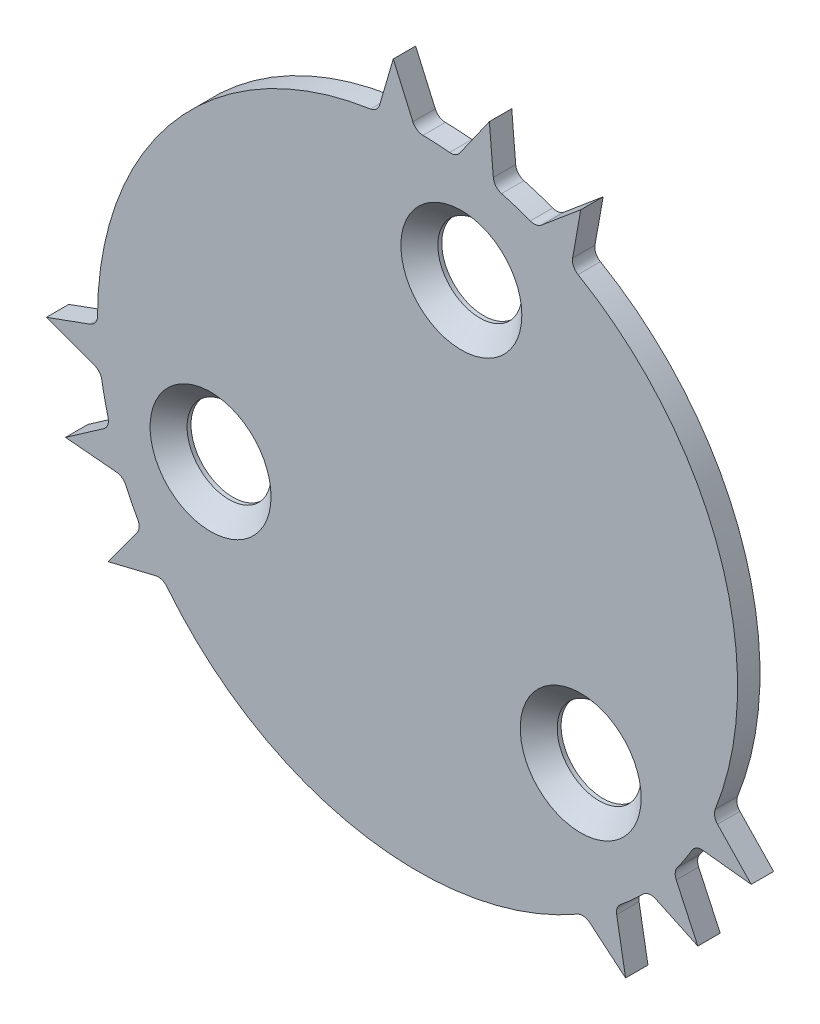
SolidWorks part; units mm, degrees
ref_plane "Ebene vorne" through (0, 0, 0) normal (0, 0, 1) x (1, 0, 0)
ref_plane "Ebene oben" through (0, 0, 0) normal (0, 1, 0) x (1, 0, 0)
ref_plane "Ebene rechts" through (0, 0, 0) normal (1, 0, 0) x (0, 0, -1)
sketch "Skizze1" plane through (0, 0, 0) normal (0, 0, 1) x (1, 0, 0)
  line L0 (-3.8571, 58.9672) -> (0.4306, -6.5833) construction
  line L1 (-14.9168, 27.6679) -> (25.0031, 30.2791) construction
  line L2 (-2.1689, 33.159) -> (-3.5687, 28.3589) construction
  line L3 (-2.1689, 33.159) -> (-0.1558, 28.5821) construction
  line L4 (-21.4185, -20.1239) -> (-26.1191, -11.9029) construction
  line L6 (0, 0) -> (17.5623, 64.9986) construction
  line L10 (0, 0) -> (45.6735, 79.1088) construction
  line L12 (-9.2404, 32.1042) -> (28.3981, 21.9345) construction
  line L13 (-6.8405, 36.9537) -> (29.8586, 15.7654) construction
  line L14 (6.4132, 32.6051) -> (3.4381, 28.375) construction
  line L15 (6.4132, 32.6051) -> (6.8273, 27.7552) construction
  line L16 (10.6094, 26.5406) -> (14.571, 29.8648) construction
  line L17 (14.571, 29.8648) -> (13.7258, 25.0712) construction
  line L28 (20.1686, -20.2532) -> (17.0795, -23.3293) construction
  line L30 (26.358, -11.539) -> (23.183, -16.9854) construction
  circle A0 centre (0, 0) radius 28.5826
  dimension "D1" = 20
  dimension "D2" = 20
  dimension "D10" = 20
  dimension "D11" = 20
  dimension "D12" = 20
  dimension "D13" = 20
  dimension "D15" = 14.88
extrude "Linear austragen2" add sketch "Skizze1" along normal blind 2
hole_wizard "Formsenkung für M5 SFHCS2" positions "3D-Skizze3" profile "Skizze5" countersink size "M5" standard "Ansi Metrisch"
sketch3d "3D-Skizze3"
  line L3 (0, 0, 0) -> (3.9125, 19.0844, 2) construction
  line L6 (0, 0, 0) -> (0, 11.9967, 0) construction
  point P0 (3.9125, 19.0844, 2)
  dimension "D1" = 19.5837
  dimension "D2" = 12.966
sketch "Skizze5" plane through (3.9125, 19.0844, 2) normal (1, 0, 0) x (0, -1, 0)
  line L0 (0, 0) -> (0, 2)
  line L1 (0, 2) -> (3.75, 2)
  line L2 (3.75, 2) -> (3.75, 1.65)
  line L3 (3.75, 1.65) -> (5.4, 0)
  line L5 (5.4, 0) -> (0, 0)
  line L6 (-3.75, 1.65) -> (-5.4, 0) construction
  line L11 (0, -6.35) -> (0, 107.95) construction
  dimension "Bohrerdurchmesser" = 7.5
  dimension "Bohrungstiefe" = 2
  dimension "Senkdurchmesser (Oben)" = 10.8
  dimension "Senkwinkel (Oben)" = 90
sketch "Skizze6" plane through (0, 0, 2) normal (0, 0, 1) x (1, 0, 0)
  line L0 (14.571, 29.8648) -> (13.7258, 25.0712) construction
  line L1 (10.6094, 26.5406) -> (14.571, 29.8648) construction
  line L2 (6.4132, 32.6051) -> (6.8273, 27.7552) construction
  line L3 (6.4132, 32.6051) -> (3.4381, 28.375) construction
  line L4 (-2.1689, 33.159) -> (-0.1558, 28.5821) construction
  line L5 (-2.1689, 33.159) -> (-3.5687, 28.3589) construction
  line L6 (14.571, 29.8648) -> (13.7258, 25.0712)
  line L7 (10.6094, 26.5406) -> (14.571, 29.8648)
  line L8 (6.4132, 32.6051) -> (6.8273, 27.7552)
  line L9 (6.4132, 32.6051) -> (3.4381, 28.375)
  line L10 (-2.1689, 33.159) -> (-0.1558, 28.5821)
  line L11 (-2.1689, 33.159) -> (-3.5687, 28.3589)
  circle A0 centre (0, 0) radius 28.5826 construction
  arc A1 (13.7258, 25.0712) -> (10.6094, 26.5406) centre (0, 0) ccw
  arc A2 (-0.1558, 28.5821) -> (-3.5687, 28.3589) centre (0, 0) ccw
  arc A3 (6.8273, 27.7552) -> (3.4381, 28.375) centre (0, 0) ccw
extrude "Linear austragen3" add sketch "Skizze6" against normal up to surface (2 mm away)
fillet "Verrundung1" radius 1 6 edges at (13.7258, 25.0712, 1) (10.6094, 26.5406, 1) (6.8273, 27.7552, 1) (3.4381, 28.375, 1) (-0.1558, 28.5821, 1) (-3.5687, 28.3589, 1)
pattern_circular "Kreismuster5" count 3 over 360 about axis through (0, 0, 0) along (0, 0, 1) of "Formsenkung für M5 SFHCS2", "Linear austragen3", "Verrundung1"
